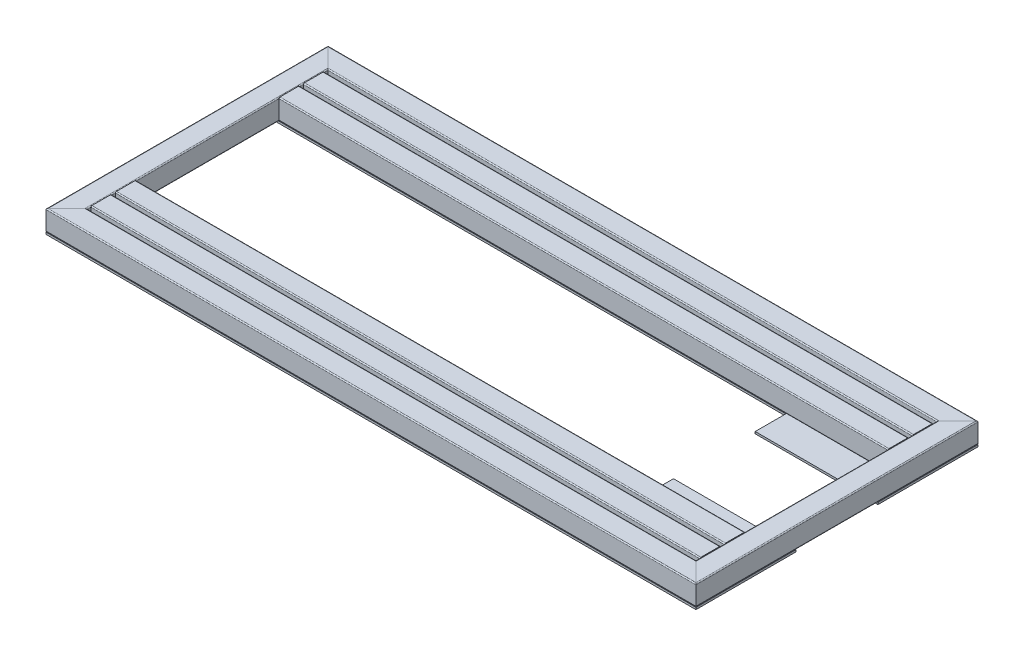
SolidWorks part; units mm, degrees
ref_plane "Front Plane" through (0, 0, 0) normal (0, 0, 1) x (1, 0, 0)
ref_plane "Top Plane" through (0, 0, 0) normal (0, 1, 0) x (1, 0, 0)
ref_plane "Right Plane" through (0, 0, 0) normal (1, 0, 0) x (0, 0, -1)
sketch "Sketch1" plane through (0, 0, 0) normal (0, 1, 0) x (1, 0, 0)
  line L0 (-1540, -520) -> (1540, -520)
  line L1 (-1540, 640) -> (1540, 640)
  line L2 (-1540, 640) -> (-1540, -640)
  line L3 (-1540, -640) -> (1540, -640)
  line L4 (1540, 640) -> (1540, -640)
  line L5 (-1540, 640) -> (1540, -640) construction
  line L6 (-1540, -640) -> (1540, 640) construction
  line L7 (-1540, -400) -> (1540, -400)
  line L8 (-1540, 520) -> (1540, 520)
  line L9 (-1540, 400) -> (1540, 400)
  point P0 (0, 0)
  dimension "D1" = 1280
  dimension "D2" = 3080
  dimension "D3" = 120
  dimension "D4" = 120
  dimension "D5" = 120
  dimension "D6" = 120
other "C 100X100X2(1)"
ref_plane "Plane1" through (-1540, 0, -640) normal (1, 0, 0) x (0, 0, -1)
sketch "Sketch11" plane through (-1540, 0, -640) normal (1, 0, 0) x (0, 0, -1)
  line L0 (-48, 45) -> (-48, -45)
  line L1 (-45, 50) -> (45, 50)
  line L2 (-50, 45) -> (-50, -45)
  line L3 (-45, -50) -> (45, -50)
  line L4 (50, 45) -> (50, -45)
  line L5 (-50, 50) -> (50, -50) construction
  line L6 (-50, -50) -> (50, 50) construction
  line L7 (-45, -48) -> (45, -48)
  line L8 (48, 45) -> (48, -45)
  line L9 (-45, 48) -> (45, 48)
  line L10 (0, 50) -> (0, -50) construction
  line L11 (-50, 0) -> (50, 0) construction
  arc A0 (45, 50) -> (50, 45) centre (45, 45) cw
  arc A1 (-50, -45) -> (-45, -50) centre (-45, -45) ccw
  arc A2 (-45, 50) -> (-50, 45) centre (-45, 45) ccw
  arc A3 (45, -50) -> (50, -45) centre (45, -45) ccw
  arc A4 (-48, -45) -> (-45, -48) centre (-45, -45) ccw
  arc A5 (45, -48) -> (48, -45) centre (45, -45) ccw
  arc A6 (45, 48) -> (48, 45) centre (45, 45) cw
  arc A7 (-45, 48) -> (-48, 45) centre (-45, 45) ccw
  point P0 (0, 0)
  point P34 (0, 0)
  dimension "D3" = 5
  dimension "D1" = 100
  dimension "D2" = 100
  dimension "D4" = 2
sketch "Sketch12" plane through (0, -50, 0) normal (0, -1, 0) x (1, 0, 0)
  line L0 (1590, 690) -> (1590, -690) construction
  line L1 (-1590, -690) -> (1590, -690)
  line L2 (-1590, -690) -> (-1590, -350)
  line L3 (-1590, -350) -> (990, -350)
  line L4 (1590, -690) -> (1590, -200)
  line L5 (1490, -350) -> (-1490, -350) construction
  line L6 (990, -350) -> (990, -200)
  line L7 (990, -200) -> (1590, -200)
  line L8 (0, 0) -> (310.1072, 0) construction
  line L9 (990, 200) -> (1590, 200)
  line L10 (990, 350) -> (990, 200)
  line L11 (1590, 690) -> (1590, 200)
  line L12 (-1590, 350) -> (990, 350)
  line L13 (-1590, 690) -> (-1590, 350)
  line L14 (-1590, 690) -> (1590, 690)
  dimension "D1" = 600
  dimension "D2" = 150
extrude "Boss-Extrude1" add sketch "Sketch12" along normal blind 10 separate body
sketch "Sketch13" plane through (0, -60, 0) normal (0, -1, 0) x (1, 0, 0)
  line L0 (-1590, -690) -> (1590, -690) construction
  line L1 (1325, -480) -> (1425, -480)
  line L2 (1325, -480) -> (1325, -535)
  line L3 (1325, -535) -> (1425, -535)
  line L4 (1425, -480) -> (1425, -535)
  line L5 (1590, -690) -> (1590, -200) construction
  line L6 (1325, -315) -> (1325, -370)
  line L7 (1325, -370) -> (1425, -370)
  line L8 (1425, -315) -> (1425, -370)
  line L9 (1325, -315) -> (1425, -315)
  line L10 (0, 0) -> (231.7521, 0) construction
  line L11 (1325, 315) -> (1425, 315)
  line L12 (1425, 315) -> (1425, 370)
  line L13 (1325, 370) -> (1425, 370)
  line L14 (1325, 315) -> (1325, 370)
  line L15 (1425, 480) -> (1425, 535)
  line L16 (1325, 535) -> (1425, 535)
  line L17 (1325, 480) -> (1325, 535)
  line L18 (1325, 480) -> (1425, 480)
  dimension "D1" = 100
  dimension "D2" = 55
  dimension "D3" = 210
  dimension "D4" = 165
  dimension "D5" = 100
  dimension "D6" = 55
  dimension "D7" = 165
extrude "Boss-Extrude2" add sketch "Sketch13" along normal blind 100 separate body
sketch "Sketch14" plane through (0, 0, 535) normal (0, 0, 1) x (1, 0, 0)
  line L0 (1325, -160) -> (1325, -60) construction
  line L1 (1425, -160) -> (1325, -160) construction
  circle A0 centre (1390, -125) radius 15
  dimension "D1" = 30
  dimension "D2" = 65
  dimension "D3" = 35
extrude "Cut-Extrude1" cut sketch "Sketch14" against normal through all
